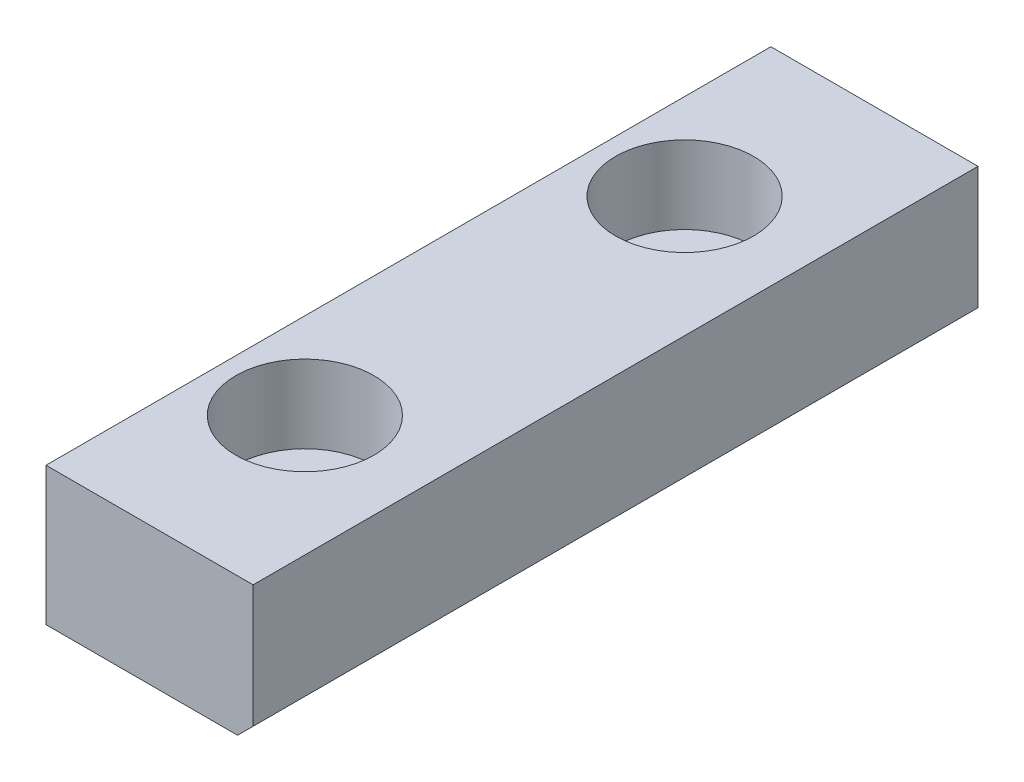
SolidWorks part; units mm, degrees
ref_plane "前视基准面" through (0, 0, 0) normal (0, 0, 1) x (1, 0, 0)
ref_plane "上视基准面" through (0, 0, 0) normal (0, 1, 0) x (1, 0, 0)
ref_plane "右视基准面" through (0, 0, 0) normal (1, 0, 0) x (0, 0, -1)
sketch "草图1" plane through (0, 0, 0) normal (0, 0, 1) x (1, 0, 0)
  line L0 (0, 0) -> (11.1, 0)
  line L1 (0, 0) -> (0, 8)
  line L2 (12, 0.9) -> (12, 8)
  line L3 (0, 8) -> (12, 8)
  line L4 (12, 0.9) -> (11.1, 0)
extrude "凸台-拉伸1" add sketch "草图1" along normal blind 42
sketch "草图2" plane through (0, 8, 0) normal (0, 1, 0) x (1, 0, 0)
  circle A0 centre (5, -10) radius 2.25
  circle A1 centre (5, -32) radius 2.25
extrude "切除-拉伸1" cut sketch "草图2" against normal blind 42
sketch "草图3" plane through (0, 8, 0) normal (0, 1, 0) x (1, 0, 0)
  circle A0 centre (5, -10) radius 4
  circle A1 centre (5, -32) radius 4
extrude "切除-拉伸2" cut sketch "草图3" against normal blind 4.5
